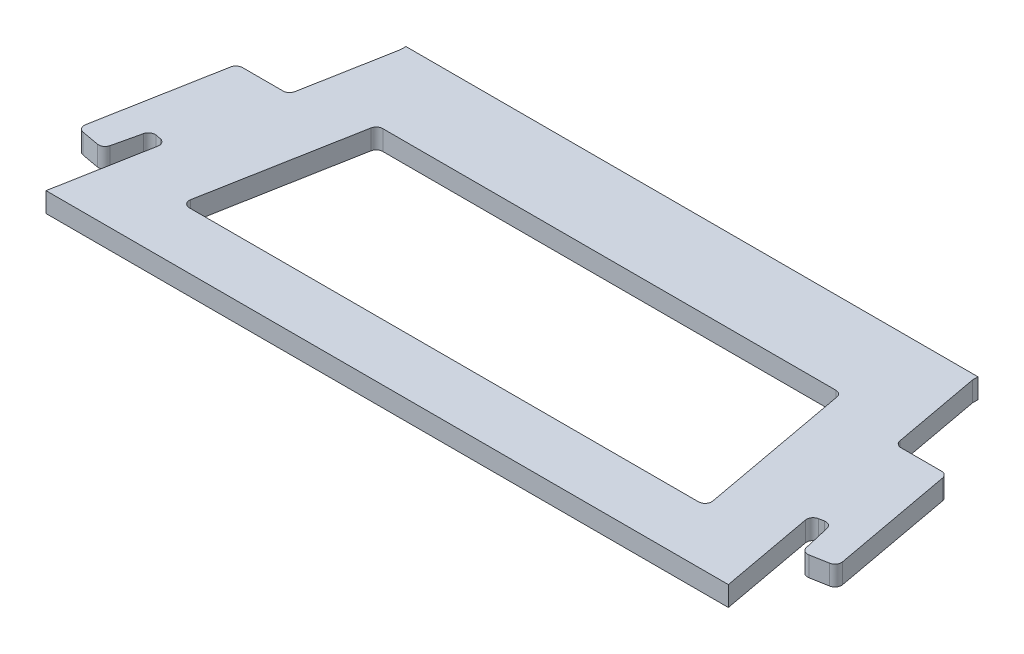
SolidWorks part; units mm, degrees
ref_plane "Front Plane" through (0, 0, 0) normal (0, 0, 1) x (1, 0, 0)
ref_plane "Top Plane" through (0, 0, 0) normal (0, 1, 0) x (1, 0, 0)
ref_plane "Right Plane" through (0, 0, 0) normal (1, 0, 0) x (0, 0, -1)
sketch "Sketch1" plane through (0, 0, 0) normal (0, 1, 0) x (1, 0, 0)
  line L0 (0, 0) -> (10.5237, 57.1247)
  line L1 (33.35, 181.03) -> (379.35, 181.03) construction
  line L2 (379.35, 181.03) -> (389.275, 127.1553)
  line L3 (412.7, 0) -> (0, 0)
  line L4 (379.35, 181.03) -> (379.35, 184.33)
  line L5 (379.35, 184.33) -> (33.35, 184.33)
  line L6 (33.35, 184.33) -> (33.35, 181.03)
  line L7 (19.4912, 123.88) -> (-5.0188, 123.88)
  line L8 (-8.9526, 120.6047) -> (-22.6041, 46.5017)
  line L9 (-19.3833, 41.841) -> (-8.7875, 39.9215)
  line L10 (-4.1776, 42.9551) -> (-0.3853, 59.3317)
  line L11 (4.2521, 62.3602) -> (7.3304, 61.7803)
  line L12 (23.425, 127.1553) -> (33.35, 181.03)
  line L13 (22.8216, 123.88) -> (11.2455, 61.0428) construction
  line L14 (-0.3853, 59.3317) -> (10.5237, 57.1247) construction
  line L15 (206.35, 0) -> (206.35, 181.03) construction
  line L16 (343.3396, 134.33) -> (69.3604, 134.33)
  line L17 (65.4266, 131.0547) -> (48.478, 39.0547)
  line L18 (52.4118, 34.33) -> (360.2882, 34.33)
  line L19 (408.4479, 62.3602) -> (405.3696, 61.7803)
  line L20 (416.8776, 42.9551) -> (413.0853, 59.3317)
  line L21 (432.0833, 41.841) -> (421.4875, 39.9215)
  line L22 (421.6526, 120.6047) -> (435.3041, 46.5017)
  line L23 (393.2088, 123.88) -> (417.7188, 123.88)
  line L24 (347.2734, 131.0547) -> (364.222, 39.0547)
  line L25 (402.1763, 57.1247) -> (412.7, 0)
  line L26 (33.35, 181.03) -> (33.35, 0) construction
  arc A0 (-0.3853, 59.3317) -> (4.2521, 62.3602) centre (3.5116, 58.4293) cw
  arc A1 (-8.7875, 39.9215) -> (-4.1776, 42.9551) centre (-8.0745, 43.8575) ccw
  arc A2 (-22.6041, 46.5017) -> (-19.3833, 41.841) centre (-18.6703, 45.777) ccw
  arc A3 (-5.0188, 123.88) -> (-8.9526, 120.6047) centre (-5.0188, 119.88) ccw
  arc A4 (19.4912, 123.88) -> (23.425, 127.1553) centre (19.4912, 127.88) ccw
  arc A5 (7.3304, 61.7803) -> (10.5237, 57.1247) centre (6.5899, 57.8494) cw
  arc A6 (48.478, 39.0547) -> (52.4118, 34.33) centre (52.4118, 38.33) ccw
  arc A7 (69.3604, 134.33) -> (65.4266, 131.0547) centre (69.3604, 130.33) ccw
  arc A8 (405.3696, 61.7803) -> (402.1763, 57.1247) centre (406.1101, 57.8494) ccw
  arc A9 (413.0853, 59.3317) -> (408.4479, 62.3602) centre (409.1884, 58.4293) ccw
  arc A10 (421.4875, 39.9215) -> (416.8776, 42.9551) centre (420.7745, 43.8575) cw
  arc A11 (435.3041, 46.5017) -> (432.0833, 41.841) centre (431.3703, 45.777) cw
  arc A12 (417.7188, 123.88) -> (421.6526, 120.6047) centre (417.7188, 119.88) cw
  arc A13 (393.2088, 123.88) -> (389.275, 127.1553) centre (393.2088, 127.88) cw
  arc A14 (364.222, 39.0547) -> (360.2882, 34.33) centre (360.2882, 38.33) cw
  arc A15 (343.3396, 134.33) -> (347.2734, 131.0547) centre (343.3396, 130.33) cw
  point P21 (-23.331, 42.5562)
  point P24 (-8.3492, 123.88)
  point P32 (206.35, 181.03)
  point P61 (206.35, 134.33)
  point P62 (206.35, 34.33)
  dimension "D9" = 4
  dimension "D10" = 4
  dimension "D14" = 24.51
  dimension "D18" = 4
  dimension "D1" = 346
  dimension "D2" = 412.7
  dimension "D3" = 181.03
  dimension "D4" = 3.3
  dimension "D5" = 90.23
  dimension "D6" = 75.35
  dimension "D7" = 60.45
  dimension "D8" = 11.13
  dimension "D11" = 16.81
  dimension "D12" = 89.83
  dimension "D13" = 92.77
  dimension "D15" = 50
  dimension "D16" = 100
  dimension "D17" = 40.6
extrude "Boss-Extrude1" add sketch "Sketch1" along normal blind 12
